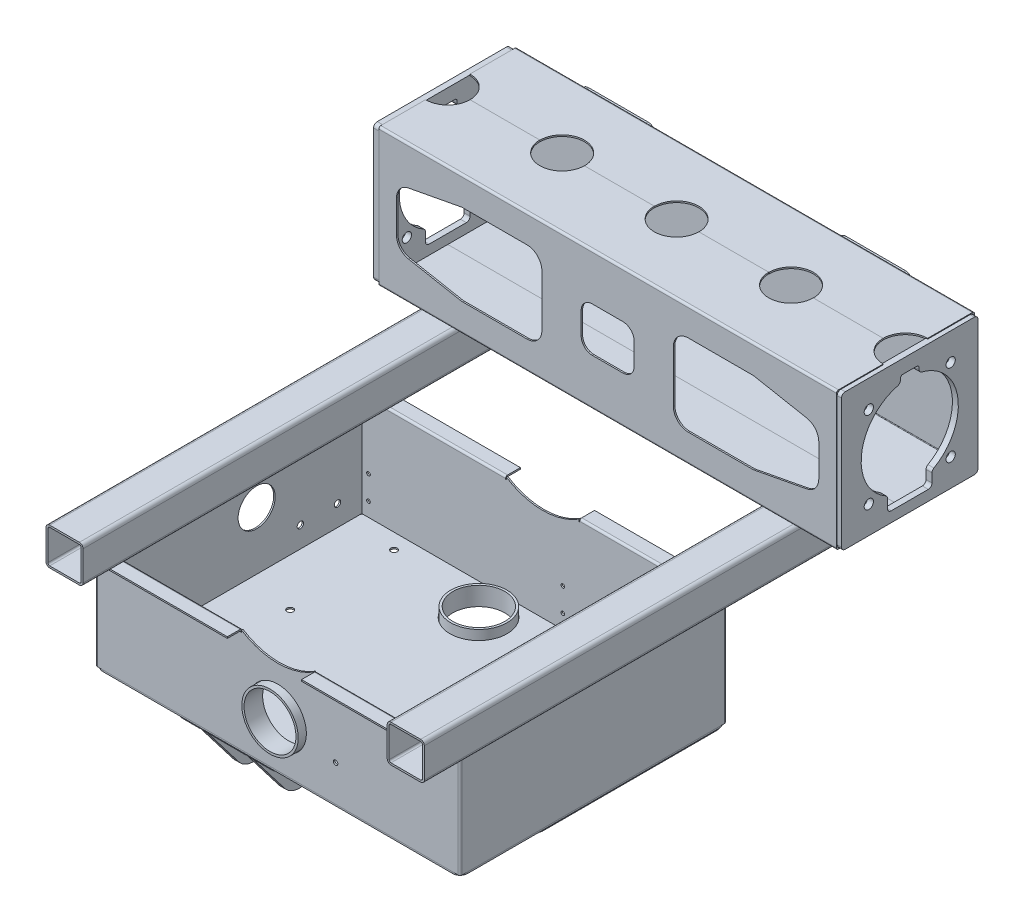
SolidWorks part; units mm, degrees
ref_plane "Plan de face" through (0, 0, 0) normal (0, 0, 1) x (1, 0, 0)
ref_plane "Plan de dessus" through (0, 0, 0) normal (0, 1, 0) x (1, 0, 0)
ref_plane "Plan de droite" through (0, 0, 0) normal (1, 0, 0) x (0, 0, -1)
inserted part "laser pont avant 1-2"
other "<laser pont avant 1-2>-<Enlèv. mat.-Extru.1>"
inserted part "laser pont avant 2-2"
move or copy body "Corps-Déplacer/Copier2" placed by mates yes
other "<laser pont avant 2-2>-<Enlèv. mat.-Extru.1>"
inserted part "laser support moteur hydr"
move or copy body "Corps-Déplacer/Copier4" placed by mates yes
other "Distance1" parameters "D1"=1
other "Distance2" parameters "D1"=1
other "<laser support moteur hydr>-<Extrusion1>"
mirror "Symétrie1" about plane through (0, 0, 0) normal (1, 0, 0)
sketch "Esquisse1" plane through (0, -92.5842, 0) normal (0, -1, 0) x (1, 0, 0)
  line L0 (-205, -48) -> (-205, 687)
  line L1 (0, -34.5888) -> (0, 170.4112) construction
  line L2 (309.6087, 0) -> (-307.3913, 0) construction
  dimension "D1" = 205
  dimension "D2" = 48
  dimension "D3" = 735
other "Elément mécano-soudé1"
ref_plane "Plan1" through (-205, -92.5842, -48) normal (0, 0, 1) x (1, 0, 0)
sketch "Sketch1" plane through (-230, -117.5842, -48) normal (0, 0, 1) x (1, 0, 0)
  line L0 (-20, -22.5) -> (20, -22.5)
  line L1 (-22.5, -20) -> (-22.5, 20)
  line L2 (20, 22.5) -> (-20, 22.5)
  line L3 (22.5, 20) -> (22.5, -20)
  line L4 (-20, -25) -> (20, -25)
  line L5 (-25, -20) -> (-25, 20)
  line L6 (20, 25) -> (-20, 25)
  line L7 (25, 20) -> (25, -20)
  arc A0 (25, 20) -> (20, 25) centre (20, 20) ccw
  arc A1 (20, -25) -> (25, -20) centre (20, -20) ccw
  arc A2 (-25, -20) -> (-20, -25) centre (-20, -20) ccw
  arc A3 (-20, 25) -> (-25, 20) centre (-20, 20) ccw
  arc A4 (-20, 22.5) -> (-22.5, 20) centre (-20, 20) ccw
  arc A5 (22.5, 20) -> (20, 22.5) centre (20, 20) ccw
  arc A6 (20, -22.5) -> (22.5, -20) centre (20, -20) ccw
  arc A7 (-22.5, -20) -> (-20, -22.5) centre (-20, -20) ccw
  point P0 (-25, 0)
  point P1 (25, 0)
  point P2 (0, 25)
  point P3 (0, -25)
  point P4 (0, 0)
  point P5 (-25, -25)
  point P6 (25, -25)
  point P7 (25, 25)
  point P8 (-25, 25)
  point P33 (0, 0)
  dimension "D1" = 5
  dimension "Thickness" = 2.5
  dimension "V_leg" = 50
mirror "Symétrie2" about plane through (0, 0, 0) normal (1, 0, 0)
sketch "Esquisse3" plane through (0, -92.5842, 0) normal (0, -1, 0) x (1, 0, 0)
  line L0 (170, 123) -> (70, 123)
  line L1 (205, 687) -> (205, -48) construction
  line L3 (-307.3913, 186) -> (309.6087, 186) construction
  dimension "D1" = 100
  dimension "D2" = 35
  dimension "D3" = 63
other "Elément mécano-soudé2"
ref_plane "Plan2" through (170, -92.5842, 123) normal (-1, 0, 0) x (0, 0, 1)
sketch "Esquisse11" plane through (170, -92.5842, 123) normal (-1, 0, 0) x (0, 0, -1)
  line L0 (0, 0) -> (0, 50)
  line L2 (5, 45) -> (5, 10)
  line L3 (10, 5) -> (25, 5)
  line L4 (30, 0) -> (0, 0)
  arc A0 (0, 50) -> (5, 45) centre (0, 45) cw
  arc A1 (5, 10) -> (10, 5) centre (10, 10) ccw
  arc A2 (25, 5) -> (30, 0) centre (25, 0) cw
  point P4 (0, 0)
  dimension "D5" = 5
  dimension "D1" = 50
  dimension "D2" = 30
  dimension "D3" = 5
  dimension "D4" = 5
sketch "Esquisse12" plane through (0, 0, 123) normal (0, 0, 1) x (1, 0, 0)
  line L0 (82.0422, -142.5842) -> (82.0422, -123.5842)
  line L1 (70, -142.5842) -> (170, -142.5842) construction
  line L2 (94.0422, -123.5842) -> (94.0422, -142.5842)
  line L3 (94.0422, -142.5842) -> (82.0422, -142.5842)
  line L5 (118.0422, -142.5842) -> (118.0422, -92.5842) construction
  line L6 (170, -92.5842) -> (70, -92.5842) construction
  line L7 (142.0422, -142.5842) -> (154.0422, -142.5842)
  line L8 (142.0422, -123.5842) -> (142.0422, -142.5842)
  line L9 (154.0422, -142.5842) -> (154.0422, -123.5842)
  line L10 (148.0422, -142.5842) -> (88.0422, -142.5842) construction
  arc A0 (82.0422, -123.5842) -> (94.0422, -123.5842) centre (88.0422, -123.5842) cw
  arc A1 (154.0422, -123.5842) -> (142.0422, -123.5842) centre (148.0422, -123.5842) ccw
  dimension "D1" = 12
  dimension "D2" = 60
  dimension "D3" = 19
extrude "Enlèv. mat.-Extru.1" cut sketch "Esquisse12" against normal through all
inserted part "laser renfort sur chassis du mât"
move or copy body "Corps-Déplacer/Copier6" placed by mates yes
other "Distance3" parameters "D1"=2
other "Distance4" parameters "D1"=92
other "<laser renfort sur chassis du mât>-<Extrusion1>"
inserted part "laser chape mât sur chassis"
move or copy body "Corps-Déplacer/Copier8" placed by mates yes
other "Distance5" parameters "D1"=39.5
other "Distance6" parameters "D1"=1
other "<laser chape mât sur chassis>-<Extrusion1>"
inserted part "laser chape mât sur chassis1"
move or copy body "Corps-Déplacer/Copier10" placed by mates yes
other "Distance7" parameters "D1"=39.5
other "<laser chape mât sur chassis>-<Extrusion1>"
mirror "Symétrie4" about plane through (0, 0, 0) normal (1, 0, 0)
inserted part "ensemble support moteur"
move or copy body "Corps-Déplacer/Copier12" placed by mates yes
other "Distance9" parameters "D1"=9.2
other "Distance8" parameters "D1"=57.5
other "<ensemble support moteur>-<Tôle pliée sur arête4>"
other "<ensemble support moteur>-<<laser plaque moteur>-<Extrusion1>>"
other "<ensemble support moteur>-<<laser renfort plaque moteur>-<Extrusion1>>"
other "<ensemble support moteur>-<Elément mécano-soudé1>"
other "<ensemble support moteur>-<Elément mécano-soudé2>"
other "<ensemble support moteur>-<<laser chape du tilt sur chassis>-<Extrusion1>>"
other "<ensemble support moteur>-<<laser chape du tilt sur chassis>-<Extrusion1>>"
